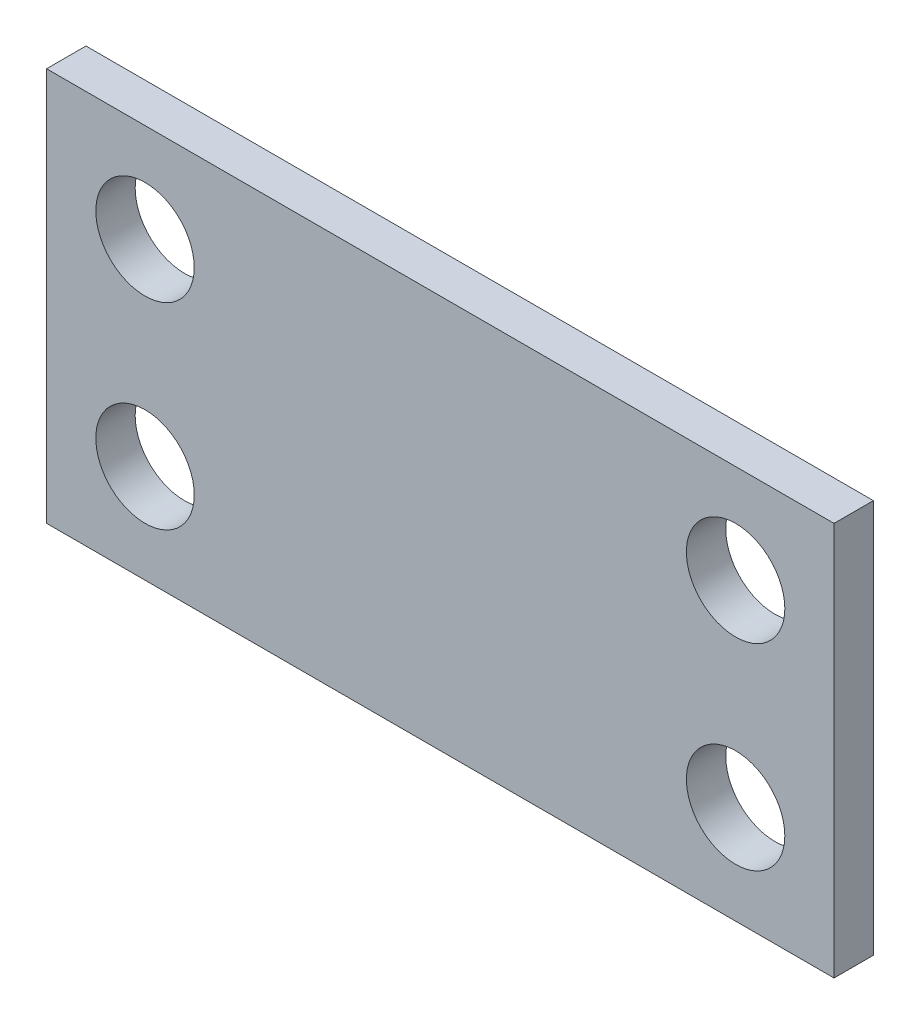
SolidWorks part; units mm, degrees
ref_plane "Front Plane" through (0, 0, 0) normal (0, 0, 1) x (1, 0, 0)
ref_plane "Top Plane" through (0, 0, 0) normal (0, 1, 0) x (1, 0, 0)
ref_plane "Right Plane" through (0, 0, 0) normal (1, 0, 0) x (0, 0, -1)
sketch "Sketch1" plane through (0, 0, 0) normal (0, 0, 1) x (1, 0, 0)
  line L1 (0, 0) -> (80, 0)
  line L2 (0, 0) -> (0, 40)
  line L3 (0, 40) -> (80, 40)
  line L4 (80, 0) -> (80, 40)
  dimension "D1" = 80
  dimension "D2" = 40
extrude "Extrude1" add sketch "Sketch1" against normal blind 4
sketch "Sketch2" plane through (0, 0, 0) normal (0, 0, 1) x (1, 0, 0)
  line L0 (80, 40) -> (0, 40) construction
  line L1 (0, 40) -> (0, 0) construction
  line L3 (0, 0) -> (80, 0) construction
  circle A0 centre (10, 30) radius 5
  circle A1 centre (10, 10) radius 5
  circle A2 centre (70, 10) radius 5
  circle A3 centre (70, 30) radius 5
  dimension "D1" = 10
  dimension "D3" = 10
  dimension "D5" = 60
  dimension "D2" = 10
  dimension "D4" = 60
  dimension "D6" = 10
  dimension "D7" = 10
  dimension "D8" = 10
extrude "Cut-Extrude1" cut sketch "Sketch2" against normal blind 10
